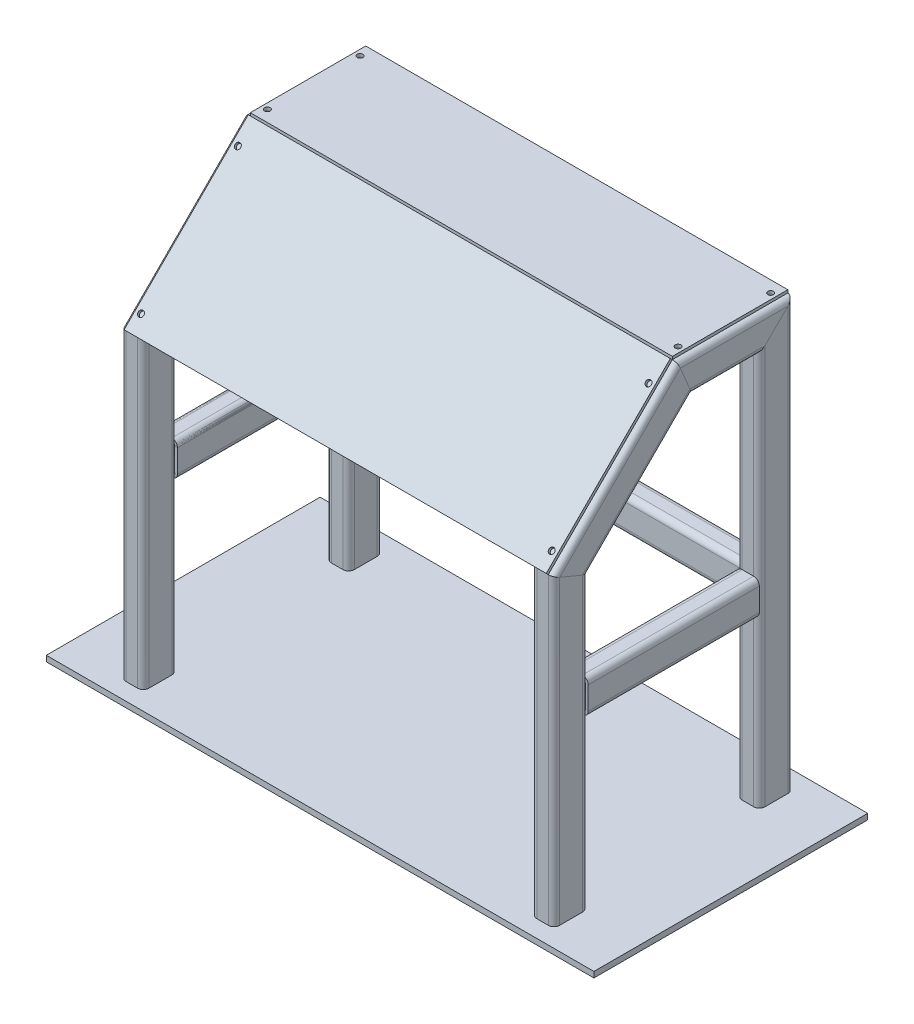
SolidWorks part; units mm, degrees
ref_plane "Front Plane" through (0, 0, 0) normal (0, 0, 1) x (1, 0, 0)
ref_plane "Top Plane" through (0, 0, 0) normal (0, 1, 0) x (1, 0, 0)
ref_plane "Right Plane" through (0, 0, 0) normal (1, 0, 0) x (0, 0, -1)
sketch "Sketch1" plane through (0, 0, 0) normal (0, 1, 0) x (1, 0, 0)
  line L0 (-609.6, 304.8) -> (609.6, -304.8) construction
  line L1 (-609.6, 304.8) -> (609.6, 304.8)
  line L2 (-609.6, 304.8) -> (-609.6, -304.8)
  line L3 (-609.6, -304.8) -> (609.6, -304.8)
  line L4 (609.6, 304.8) -> (609.6, -304.8)
  dimension "D1" = 1219.2
  dimension "D2" = 609.6
extrude "Extrude1" add sketch "Sketch1" along normal blind 12.7
sketch3d "3DSketch1"
  line L0 (-457.2, 12.7, -228.6) -> (-457.2, 927.1, -228.6)
  line L1 (-457.2, 927.1, -228.6) -> (-457.2, 927.1, -25.4)
  line L2 (-457.2, 927.1, -25.4) -> (-457.2, 673.1, 228.6)
  line L3 (-457.2, 673.1, 228.6) -> (-457.2, 12.7, 228.6)
  line L4 (457.2, 419.1, 228.6) -> (457.2, 419.1, -228.6)
  line L5 (-457.2, 419.1, -228.6) -> (-457.2, 419.1, 228.6)
  line L6 (457.2, 12.7, 228.6) -> (457.2, 673.1, 228.6)
  line L7 (457.2, 673.1, 228.6) -> (457.2, 927.1, -25.4)
  line L8 (457.2, 927.1, -25.4) -> (457.2, 927.1, -228.6)
  line L9 (457.2, 927.1, -228.6) -> (457.2, 12.7, -228.6)
  line L10 (-457.2, 419.1, -228.6) -> (457.2, 419.1, -228.6)
  dimension "D1" = 152.4
  dimension "D2" = 203.2
  dimension "D3" = 457.2
  dimension "D4" = 914.4
  dimension "D5" = 45
  dimension "D7" = 406.4
  dimension "D6" = 76.2
  dimension "D8" = 152.4
  dimension "D9" = 914.4
  dimension "D10" = 457.2
  dimension "D11" = 45
  dimension "D12" = 203.2
  dimension "D13" = 76.2
  dimension "D14" = 406.4
other "Structural Member1"
ref_plane "Plane1" through (-457.2, 673.1, 228.6) normal (0, -1, 0) x (1, 0, 0)
sketch "Sketch11" plane through (-457.2, 673.1, 228.6) normal (0, -1, 0) x (1, 0, 0)
  line L0 (-12.7, -31.75) -> (12.7, -31.75)
  line L1 (-19.05, -25.4) -> (-19.05, 25.4)
  line L2 (12.7, 31.75) -> (-12.7, 31.75)
  line L3 (19.05, 25.4) -> (19.05, -25.4)
  line L4 (-12.7, -38.1) -> (12.7, -38.1)
  line L5 (-25.4, -25.4) -> (-25.4, 25.4)
  line L6 (12.7, 38.1) -> (-12.7, 38.1)
  line L7 (25.4, 25.4) -> (25.4, -25.4)
  line L8 (0, 0) -> (25.4, 0) construction
  line L9 (0, 0) -> (0, 38.1) construction
  arc A0 (25.4, 25.4) -> (12.7, 38.1) centre (12.7, 25.4) ccw
  arc A1 (12.7, -38.1) -> (25.4, -25.4) centre (12.7, -25.4) ccw
  arc A2 (-25.4, -25.4) -> (-12.7, -38.1) centre (-12.7, -25.4) ccw
  arc A3 (-12.7, 38.1) -> (-25.4, 25.4) centre (-12.7, 25.4) ccw
  arc A4 (-12.7, 31.75) -> (-19.05, 25.4) centre (-12.7, 25.4) ccw
  arc A5 (19.05, 25.4) -> (12.7, 31.75) centre (12.7, 25.4) ccw
  arc A6 (12.7, -31.75) -> (19.05, -25.4) centre (12.7, -25.4) ccw
  arc A7 (-19.05, -25.4) -> (-12.7, -31.75) centre (-12.7, -25.4) ccw
  point P3 (0, -38.1)
  point P4 (-25.4, 0)
  point P5 (0, 0)
  point P6 (25.4, -38.1)
  point P7 (-25.4, -38.1)
  point P8 (-25.4, 38.1)
  point P33 (0, 0)
  point P35 (25.4, 38.1)
  point P36 (25.4, 0)
  point P37 (0, 38.1)
  dimension "D1" = 12.7
  dimension "Thickness" = 6.35
  dimension "V_leg" = 76.2
  dimension "H_leg" = 50.8
other "Structural Member3"
ref_plane "Plane3" through (457.2, 12.7, 228.6) normal (0, 1, 0) x (-1, 0, 0)
sketch "Sketch13" plane through (457.2, 12.7, 228.6) normal (0, 1, 0) x (-1, 0, 0)
  line L0 (-12.7, -31.75) -> (12.7, -31.75)
  line L1 (-19.05, -25.4) -> (-19.05, 25.4)
  line L2 (12.7, 31.75) -> (-12.7, 31.75)
  line L3 (19.05, 25.4) -> (19.05, -25.4)
  line L4 (-12.7, -38.1) -> (12.7, -38.1)
  line L5 (-25.4, -25.4) -> (-25.4, 25.4)
  line L6 (12.7, 38.1) -> (-12.7, 38.1)
  line L7 (25.4, 25.4) -> (25.4, -25.4)
  line L8 (0, 0) -> (25.4, 0) construction
  line L9 (0, 0) -> (0, 38.1) construction
  arc A0 (25.4, 25.4) -> (12.7, 38.1) centre (12.7, 25.4) ccw
  arc A1 (12.7, -38.1) -> (25.4, -25.4) centre (12.7, -25.4) ccw
  arc A2 (-25.4, -25.4) -> (-12.7, -38.1) centre (-12.7, -25.4) ccw
  arc A3 (-12.7, 38.1) -> (-25.4, 25.4) centre (-12.7, 25.4) ccw
  arc A4 (-12.7, 31.75) -> (-19.05, 25.4) centre (-12.7, 25.4) ccw
  arc A5 (19.05, 25.4) -> (12.7, 31.75) centre (12.7, 25.4) ccw
  arc A6 (12.7, -31.75) -> (19.05, -25.4) centre (12.7, -25.4) ccw
  arc A7 (-19.05, -25.4) -> (-12.7, -31.75) centre (-12.7, -25.4) ccw
  point P3 (0, -38.1)
  point P4 (-25.4, 0)
  point P5 (0, 0)
  point P6 (25.4, -38.1)
  point P7 (-25.4, -38.1)
  point P8 (-25.4, 38.1)
  point P33 (0, 0)
  point P35 (25.4, 38.1)
  point P36 (25.4, 0)
  point P37 (0, 38.1)
  dimension "D1" = 12.7
  dimension "Thickness" = 6.35
  dimension "V_leg" = 76.2
  dimension "H_leg" = 50.8
other "Structural Member2"
ref_plane "Plane2" through (-457.2, 419.1, -228.6) normal (0, 0, 1) x (1, 0, 0)
sketch "Sketch12" plane through (-457.2, 419.1, -228.6) normal (0, 0, 1) x (1, 0, 0)
  line L0 (-12.7, -31.75) -> (12.7, -31.75)
  line L1 (-19.05, -25.4) -> (-19.05, 25.4)
  line L2 (12.7, 31.75) -> (-12.7, 31.75)
  line L3 (19.05, 25.4) -> (19.05, -25.4)
  line L4 (-12.7, -38.1) -> (12.7, -38.1)
  line L5 (-25.4, -25.4) -> (-25.4, 25.4)
  line L6 (12.7, 38.1) -> (-12.7, 38.1)
  line L7 (25.4, 25.4) -> (25.4, -25.4)
  line L8 (0, 0) -> (25.4, 0) construction
  line L9 (0, 0) -> (0, 38.1) construction
  arc A0 (25.4, 25.4) -> (12.7, 38.1) centre (12.7, 25.4) ccw
  arc A1 (12.7, -38.1) -> (25.4, -25.4) centre (12.7, -25.4) ccw
  arc A2 (-25.4, -25.4) -> (-12.7, -38.1) centre (-12.7, -25.4) ccw
  arc A3 (-12.7, 38.1) -> (-25.4, 25.4) centre (-12.7, 25.4) ccw
  arc A4 (-12.7, 31.75) -> (-19.05, 25.4) centre (-12.7, 25.4) ccw
  arc A5 (19.05, 25.4) -> (12.7, 31.75) centre (12.7, 25.4) ccw
  arc A6 (12.7, -31.75) -> (19.05, -25.4) centre (12.7, -25.4) ccw
  arc A7 (-19.05, -25.4) -> (-12.7, -31.75) centre (-12.7, -25.4) ccw
  point P3 (0, -38.1)
  point P4 (-25.4, 0)
  point P5 (0, 0)
  point P6 (25.4, -38.1)
  point P7 (-25.4, -38.1)
  point P8 (-25.4, 38.1)
  point P33 (0, 0)
  point P35 (25.4, 38.1)
  point P36 (25.4, 0)
  point P37 (0, 38.1)
  dimension "D1" = 12.7
  dimension "Thickness" = 6.35
  dimension "V_leg" = 76.2
  dimension "H_leg" = 50.8
other "Trim/Extend1"
other "Trim/Extend2"
sketch "Sketch14" plane through (0, 477.7908, 477.7908) normal (0, 0.7071, 0.7071) x (1, 0, 0)
  line L1 (-469.9, 689.3007) -> (469.9, 689.3007)
  line L2 (-469.9, 689.3007) -> (-469.9, 298.5274)
  line L3 (-469.9, 298.5274) -> (469.9, 298.5274)
  line L4 (469.9, 689.3007) -> (469.9, 298.5274)
extrude "Extrude2" add sketch "Sketch14" along normal blind 6.35 separate body
sketch "Sketch15" plane through (0, 965.2, 0) normal (0, 1, 0) x (1, 0, 0)
  line L1 (-469.9, 266.7) -> (469.9, 266.7)
  line L2 (-469.9, 266.7) -> (-469.9, 9.6185)
  line L3 (-469.9, 9.6185) -> (469.9, 9.6185)
  line L4 (469.9, 266.7) -> (469.9, 9.6185)
extrude "Extrude3" add sketch "Sketch15" along normal blind 6.35 separate body
sketch "Sketch16" plane through (0, 482.2809, 482.2809) normal (0, 0.7071, 0.7071) x (1, 0, 0)
  line L0 (-469.9, 689.3007) -> (469.9, 689.3007) construction
  line L1 (-469.9, 689.3007) -> (-469.9, 298.5274) construction
  line L2 (469.9, 689.3007) -> (469.9, 298.5274) construction
  circle A0 centre (-457.2, 638.5007) radius 6.35
  circle A1 centre (-457.2, 333.7007) radius 6.35
  circle A2 centre (457.2, 638.5007) radius 6.35
  circle A3 centre (457.2, 333.7007) radius 6.35
  dimension "D1" = 12.7
  dimension "D2" = 304.8
  dimension "D3" = 50.8
  dimension "D5" = 12.7
  dimension "D4" = 12.7
extrude "Cut-Extrude1" cut sketch "Sketch16" against normal blind 12.7
sketch "Sketch17" plane through (0, 971.55, 0) normal (0, 1, 0) x (1, 0, 0)
  line L0 (-469.9, 9.6185) -> (-469.9, 266.7) construction
  line L2 (469.9, 9.6185) -> (469.9, 266.7) construction
  line L3 (-469.9, 9.6185) -> (469.9, 9.6185) construction
  line L4 (469.9, 266.7) -> (-469.9, 266.7) construction
  circle A0 centre (-457.2, 241.3) radius 6.35
  circle A1 centre (-457.2, 35.0185) radius 6.35
  circle A2 centre (457.2, 241.3) radius 6.35
  circle A3 centre (457.2, 35.0185) radius 6.35
  dimension "D1" = 12.7
  dimension "D2" = 12.7
  dimension "D3" = 25.4
  dimension "D4" = 25.4
  dimension "D5" = 12.7
extrude "Cut-Extrude2" cut sketch "Sketch17" against normal blind 12.7
